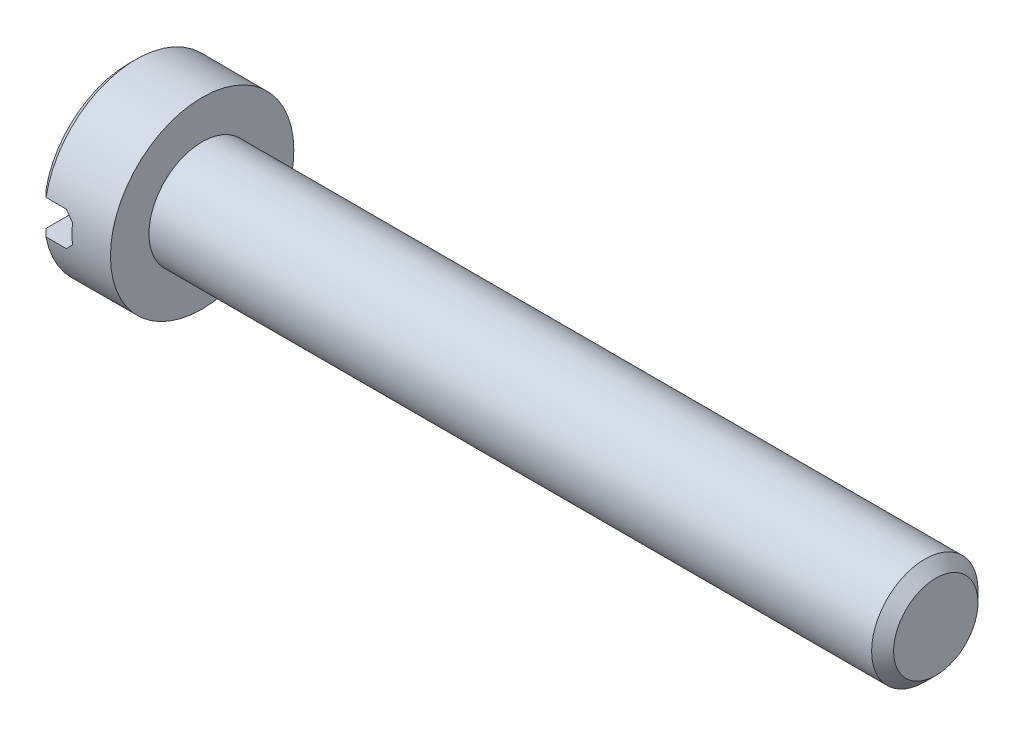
SolidWorks part; units mm, degrees
ref_plane "Face" through (0, 0, 0) normal (0, 0, 1) x (1, 0, 0)
ref_plane "Dessus" through (0, 0, 0) normal (0, 1, 0) x (1, 0, 0)
ref_plane "Droite" through (0, 0, 0) normal (1, 0, 0) x (0, 0, -1)
sketch "Esquisse1" plane through (0, 0, 0) normal (0, 0, 1) x (1, 0, 0)
  line L0 (0, 0) -> (0, 2.3)
  line L1 (0.2, 2.5) -> (2, 2.5)
  line L2 (2, 2.5) -> (2, 0)
  line L5 (0, 0) -> (7.6423, 0) construction
  line L7 (0, 2.3) -> (0.2, 2.5)
  line L8 (0, 0) -> (2, 0)
  point P1 (0, 2.5)
  dimension "D1" = 2.5
  dimension "D3" = 2
revolve "Révolution1" add sketch "Esquisse1" angle 360 about L5
sketch "Esquisse2" plane through (0, 0, 0) normal (0, 0, 1) x (1, 0, 0)
  line L0 (0, 2.3) -> (0, -2.3) construction
  line L1 (0, 0.4655) -> (0.7534, 0.4655)
  line L2 (0, 0.4655) -> (0, -0.4655)
  line L3 (0, -0.4655) -> (0.7534, -0.4655)
  line L4 (0.9534, 0.2655) -> (0.9534, -0.2655)
  line L5 (0.7534, 0.4655) -> (0.9534, 0.2655)
  line L6 (0.7534, -0.4655) -> (0.9534, -0.2655)
  point P1 (0.9534, -0.4655)
  point P3 (0.9534, 0.4655)
extrude "Enlèv. mat.-Extru.1" cut sketch "Esquisse2" against normal mid plane 10
sketch "Esquisse3" plane through (2, 0, 0) normal (1, 0, 0) x (0, 0, -1)
  circle A0 centre (0, 0) radius 1.45
extrude "Extrusion1" add sketch "Esquisse3" along normal blind 20
chamfer "Chanfrein1" distance 0.3 angle 45 1 edges at (22, 0, -1.45)
